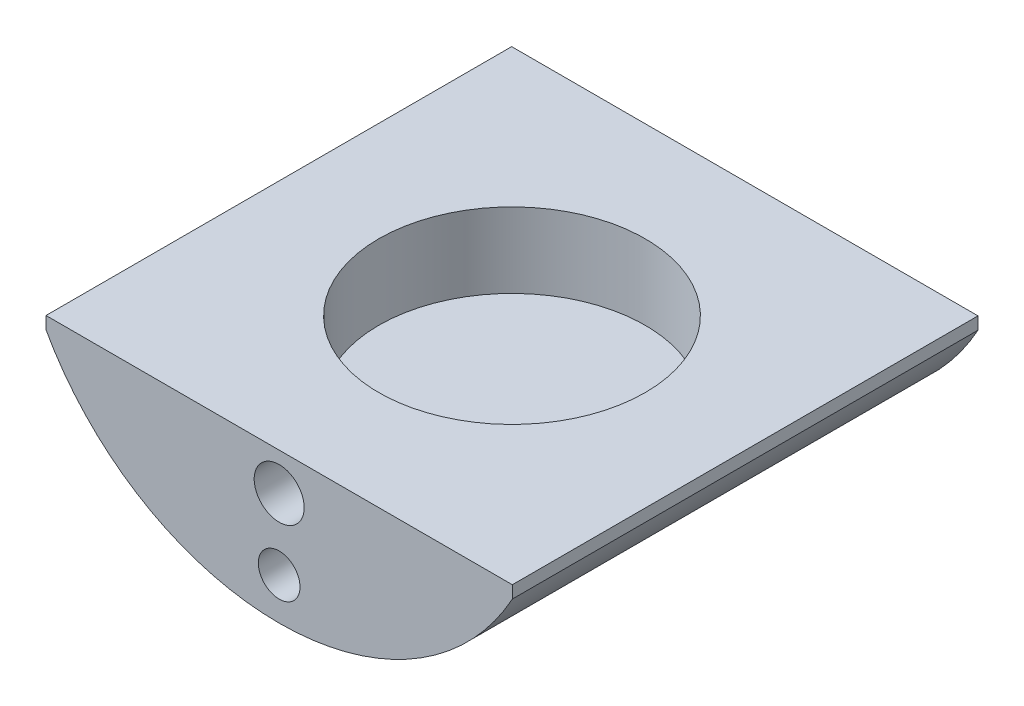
SolidWorks part; units mm, degrees
ref_plane "Front" through (0, 0, 0) normal (0, 0, 1) x (1, 0, 0)
ref_plane "Top" through (0, 0, 0) normal (0, 1, 0) x (1, 0, 0)
ref_plane "Right" through (0, 0, 0) normal (1, 0, 0) x (0, 0, -1)
sketch "Sketch1" plane through (0, 0, 0) normal (0, 0, 1) x (1, 0, 0)
  line L0 (-44.45, 0) -> (44.45, 0)
  line L1 (-44.45, 0) -> (-44.45, -2.3684)
  line L2 (50, 0) -> (-50, 0) construction
  line L3 (44.45, -2.3684) -> (44.45, 0)
  line L4 (0, 39.9875) -> (0, -57.418) construction
  line L5 (0, -50) -> (0, 50) construction
  arc A0 (-44.45, -2.3684) -> (44.45, -2.3684) centre (0, 22.225) ccw
  dimension "D3" = 50.8
  dimension "D1" = 28.575
  dimension "D2" = 88.9
extrude "Base-Extrude" add sketch "Sketch1" against normal mid plane 88.773
other "Hole1" parameters "D1"=14.2875
sketch "Sketch2" plane through (0, 0, 0) normal (0, 1, 0) x (-1, 0, 0)
  circle A0 centre (0, 0) radius 25.4
  dimension "D1" = 50.8
other "Hole2" parameters "D1"=14.2875
sketch "Sketch4" plane through (0, 0, 44.3865) normal (0, 0, 1) x (1, 0, 0)
  line L0 (-44.45, 0) -> (44.45, 0) construction
  line L1 (0, -50) -> (0, 50) construction
  circle A0 centre (0, -7.1438) radius 4.7625
  dimension "D1" = 9.525
  dimension "D2" = 7.1437
sketch "Sketch5" plane through (-3.0654, -13.7769, 44.3865) normal (0, 0, 1) x (1, 0, 0)
  line L0 (3.0654, -36.2231) -> (3.0654, 63.7769) construction
  line L1 (-41.3846, 13.7769) -> (47.5154, 13.7769) construction
  circle A0 centre (3.0654, -6.8479) radius 3.9751
  dimension "D1" = 7.9502
  dimension "D2" = 20.6248
other "Hole3" parameters "D1"=17.4625
mirror "Mirror1" about plane through (0, 0, 0) normal (0, 0, 1) of "Hole3", "Hole2"
